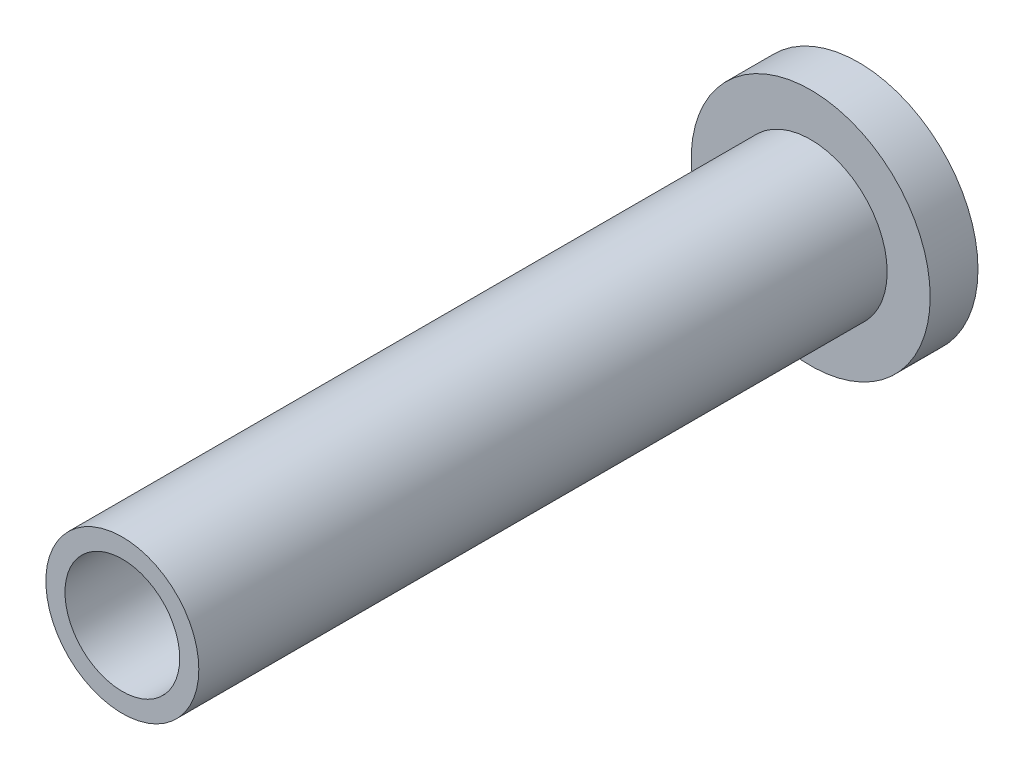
SolidWorks part; units mm, degrees
ref_plane "Plan1" through (0, 0, 0) normal (0, 0, 1) x (1, 0, 0)
ref_plane "Plan2" through (0, 0, 0) normal (0, 1, 0) x (1, 0, 0)
ref_plane "Plan3" through (0, 0, 0) normal (1, 0, 0) x (0, 0, -1)
sketch "Esquisse1" plane through (0, 0, 0) normal (0, 0, 1) x (1, 0, 0)
  circle A0 centre (0, 0) radius 12.5
  dimension "D1" = 25
extrude "Base-Extrusion" add sketch "Esquisse1" along normal blind 5
sketch "Esquisse2" plane through (0, 0, 5) normal (0, 0, 1) x (1, 0, 0)
  circle A0 centre (0, 0) radius 8
  dimension "D1" = 16
extrude "Boss.-Extru.1" add sketch "Esquisse2" along normal blind 72
sketch "Esquisse3" plane through (0, 0, 77) normal (0, 0, 1) x (1, 0, 0)
  circle A0 centre (0, 0) radius 3
  dimension "D1" = 6
extrude "Enlèv. mat.-Extru.1" cut sketch "Esquisse3" against normal through all
sketch "Esquisse4" plane through (0, 0, 77) normal (0, 0, 1) x (1, 0, 0)
  circle A0 centre (0, 0) radius 5.25
  dimension "D1" = 10.5
extrude "Enlèv. mat.-Extru.2" cut sketch "Esquisse4" against normal blind 62
sketch "Esquisse5" plane through (0, 0, 77) normal (0, 0, 1) x (1, 0, 0)
  circle A0 centre (0, 0) radius 6
  dimension "D1" = 12
extrude "Enlèv. mat.-Extru.3" cut sketch "Esquisse5" against normal blind 11
chamfer "Chanfrein8" distance 2.2 angle 30
